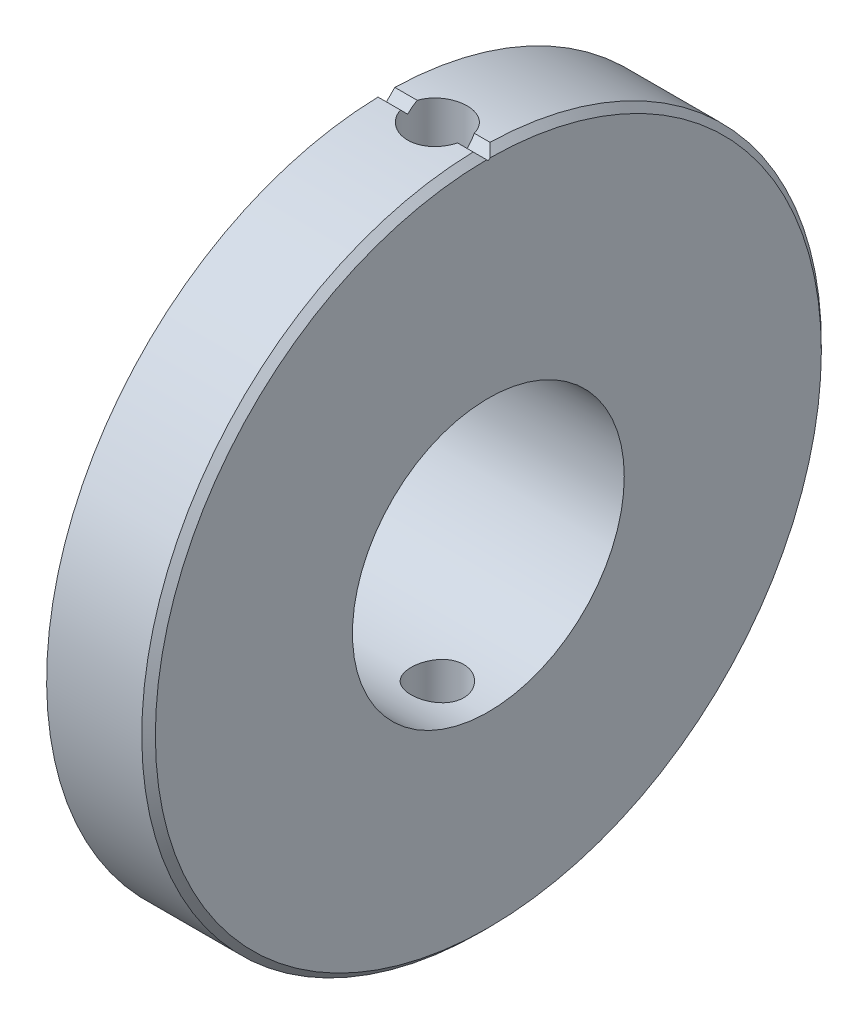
SolidWorks part; units mm, degrees
ref_plane "Face" through (0, 0, 0) normal (0, 0, 1) x (1, 0, 0)
ref_plane "Dessus" through (0, 0, 0) normal (0, 1, 0) x (1, 0, 0)
ref_plane "Droite" through (0, 0, 0) normal (1, 0, 0) x (0, 0, -1)
sketch "Esquisse1" plane through (0, 0, 0) normal (0, 0, 1) x (1, 0, 0)
  line L0 (0, 0) -> (0, 10)
  line L1 (0, 10) -> (6.5, 10)
  line L2 (6.5, 10) -> (6.5, 20)
  line L3 (6.5, 20) -> (12.5, 20)
  line L4 (12.5, 20) -> (12.5, 0)
  line L5 (0, 0) -> (12.5, 0)
  line L6 (0, 0) -> (22.364, 0) construction
  dimension "D1" = 20
  dimension "D2" = 40
  dimension "D3" = 6.5
  dimension "D4" = 12.5
revolve "Base-Révolution" add sketch "Esquisse1" angle 360 about L6
chamfer "Chanfrein1" distance 0.4 angle 45 2 edges at (12.5, 0, 20) (0, 0, 10)
sketch "Esquisse2" plane through (12.5, 0, 0) normal (1, 0, 0) x (0, 0, -1)
  line L0 (0, 0) -> (-25.5732, 0) construction
  circle A0 centre (0, -0.6) radius 8
  dimension "D1" = 0.6
  dimension "D2" = 16
extrude "Enlèv. mat.-Extru.1" cut sketch "Esquisse2" against normal through all
sketch "Esquisse3" plane through (0, 0, 0) normal (0, 1, 0) x (1, 0, 0)
  line L0 (0, 0) -> (24.327, 0) construction
  circle A0 centre (9.5, 0) radius 1.55
  dimension "D1" = 3.1
extrude "Enlèv. mat.-Extru.2" cut sketch "Esquisse3" against normal through all and the other way through all
sketch "Esquisse6" plane through (12.5, 0, 0) normal (1, 0, 0) x (0, 0, -1)
  line L0 (0, 0) -> (0, 28.5982) construction
  line L1 (0, 19.5) -> (-3, 22.5)
  line L2 (-3, 22.5) -> (3, 22.5)
  line L3 (3, 22.5) -> (0, 19.5)
  dimension "D1" = 19.5
  dimension "D2" = 45
  dimension "D3" = 45
extrude "Enlèv. mat.-Extru.3" cut sketch "Esquisse6" against normal through all
ref_plane "Plan1" through (0, 10, 0) normal (0, 1, 0) x (-1, 0, 0)
sketch "Esquisse9" plane through (0, 10, 0) normal (0, 1, 0) x (-1, 0, 0)
  circle A0 centre (-9.5, 0) radius 1.75
  arc A1 (-8.0308, 0.4939) -> (-10.9692, 0.4939) centre (-9.5, 0) ccw construction
  dimension "D1" = 3.5
extrude "Enlèv. mat.-Extru.4" cut sketch "Esquisse9" along normal blind 10
